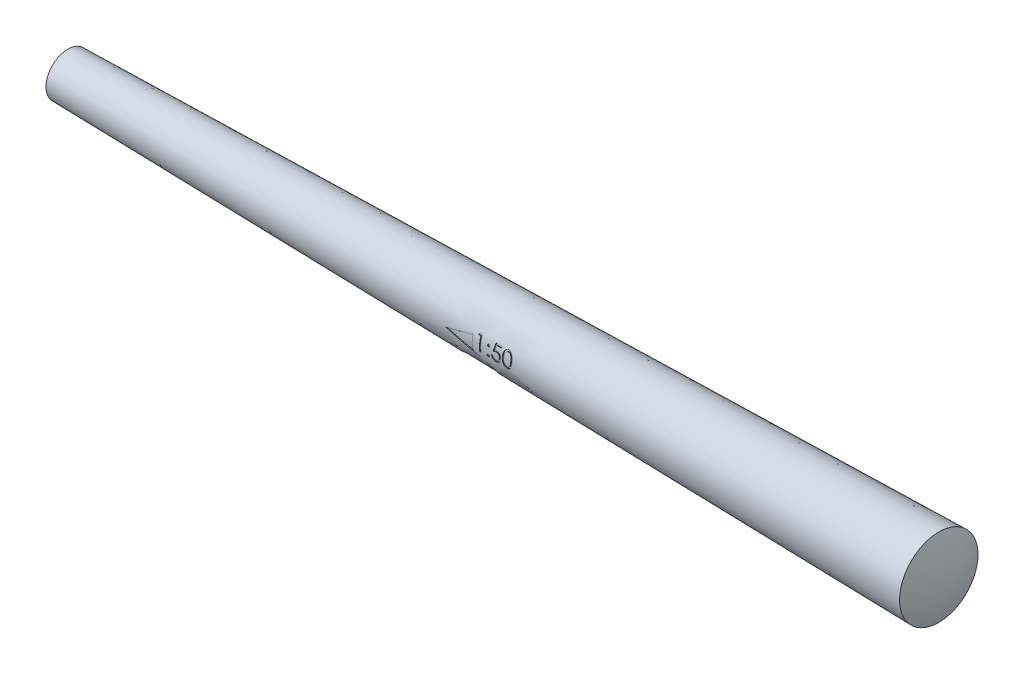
SolidWorks part; units mm, degrees
ref_plane "Front Plane" through (0, 0, 0) normal (0, 0, 1) x (1, 0, 0)
ref_plane "Top Plane" through (0, 0, 0) normal (0, 1, 0) x (1, 0, 0)
ref_plane "Right Plane" through (0, 0, 0) normal (1, 0, 0) x (0, 0, -1)
sketch "Sketch1" plane through (0, 0, 0) normal (1, 0, 0) x (0, 0, -1)
  circle A0 centre (0, 0) radius 1.5
  dimension "D1" = 3
extrude "Extrude1" add sketch "Sketch1" along normal mid plane 60
draft "Draft1" type of draft neutral plane draft angle 1.146 faces to draft 1 parameters "D1"=1.146
sketch "Sketch2" plane through (0, 0, 0) normal (0, 0, 1) x (1, 0, 0)
  line L0 (-30, 0) -> (-30, 1.5)
  line L1 (-30, 1.5) -> (-30, -1.5) construction
  line L2 (-30, 0) -> (-30.45, 0)
  line L3 (-30.45, 0) -> (-30.45, -2.1) construction
  line L4 (30, 0) -> (30, 2.7)
  line L5 (30, -2.7) -> (30, 2.7) construction
  line L6 (30, 0) -> (30.45, 0)
  line L7 (30.45, 0) -> (30.45, -2.1) construction
  line L8 (-30, -1.5) -> (30, -2.7) construction
  arc A0 (-30.45, 0) -> (-30, 1.5) centre (-27.725, 0) cw
  arc A1 (30.45, 0) -> (30, 2.7) centre (22.1248, 0) ccw
  point P14 (0, -2.1)
revolve "Revolve1" add sketch "Sketch2" angle 360 about L2
sketch "Sketch5" plane through (0, 0, 0) normal (0, 0, 1) x (1, 0, 0)
  line L0 (0, 2.1) -> (0, -2.1) construction
  line L1 (30, 2.7) -> (-30, 1.5) construction
  line L2 (-30, -1.5) -> (30, -2.7) construction
ref_plane "Plane2" through (0, 0, 0) normal (-0.02, 0, 0.9998) x (0.9998, 0, 0.02)
sketch "Sketch6" plane through (0, 0, 0) normal (-0.02, 0, 0.9998) x (0.9998, 0, 0.02)
  line L0 (0, 0) -> (0, 0.5)
  line L1 (0, 2.1) -> (0, -2.1) construction
  line L2 (0, 0.5) -> (-1.866, 0)
  line L3 (-1.866, 0) -> (0, -0.5)
  line L4 (0, -0.5) -> (0, 0)
  line L5 (0, -0.25) -> (3, -0.25) construction
  text T0 "1:50" font "Century Gothic" height 1
  dimension "D1" = 1
  dimension "D2" = 30
  dimension "D3" = 3
wrap "Wrap2" sketch "Sketch6" wrap type deboss source sketch "Sketch6" thickness 0.05 parameters "D1"=0.05
equation "\"D2@Sketch2\" = \"D1@Sketch2\""
